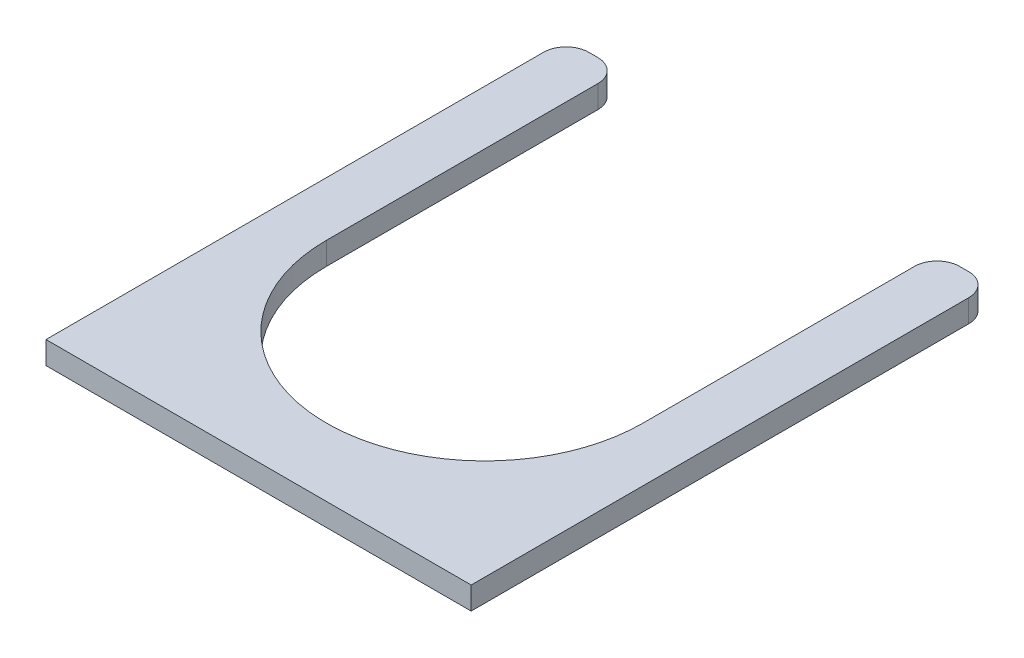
SolidWorks part; units mm, degrees
ref_plane "Piano frontale" through (0, 0, 0) normal (0, 0, 1) x (1, 0, 0)
ref_plane "Piano superiore" through (0, 0, 0) normal (0, 1, 0) x (1, 0, 0)
ref_plane "Piano destro" through (0, 0, 0) normal (1, 0, 0) x (0, 0, -1)
sketch "Schizzo1" plane through (0, 0, 0) normal (0, 1, 0) x (1, 0, 0)
  line L0 (0, 0) -> (0, 97.2212) construction
  line L2 (-47, 52.5) -> (-47, -57.5)
  line L3 (-47, -57.5) -> (47, -57.5)
  line L4 (47, 52.5) -> (47, -57.5)
  line L5 (-47, 57.5) -> (47, -57.5) construction
  line L6 (-47, -57.5) -> (47, 57.5) construction
  line L7 (-42, 57.5) -> (-40, 57.5)
  line L8 (42, 57.5) -> (40, 57.5)
  line L9 (-35, 52.5) -> (-35, -7.5)
  line L10 (35, 52.5) -> (35, -7.5)
  line L11 (0, -57.5) -> (0, -7.25) construction
  arc A0 (-35, -7.5) -> (35, -7.5) centre (0, -7.5) ccw
  arc A1 (42, 57.5) -> (47, 52.5) centre (42, 52.5) cw
  arc A2 (40, 57.5) -> (35, 52.5) centre (40, 52.5) ccw
  arc A3 (-40, 57.5) -> (-35, 52.5) centre (-40, 52.5) cw
  arc A4 (-42, 57.5) -> (-47, 52.5) centre (-42, 52.5) ccw
  point P0 (0, 0)
  point P20 (35, 57.5)
  point P23 (-35, 57.5)
base flange "Base-Flangia1" sketch "Schizzo1" thickness 5 reverse thickness direction no parameters "D1"=1.5
sketch "Linee di piegatura1" [suppressed] plane through (0, 0, 0) normal (0, 1, 0) x (1, 0, 0)
sketch "Casella di contorno1" [suppressed] plane through (0, 0, 0) normal (0, 1, 0) x (1, 0, 0)
sheet metal parameters "Lamiera1" thickness 5 parameters "D1"=1.5
flat pattern "Ripetizione piatta1"
sketch "Linee di piegatura2" plane through (0, 0, 0) normal (0, 1, 0) x (1, 0, 0)
sketch3d "Casella di contorno2" [suppressed]
  line L0 (89, 5, 0) -> (89, -110, 0) construction
  line L1 (-5, 5, 0) -> (-5, -110, 0) construction
  line L2 (89, 5, 0) -> (-5, 5, 0) construction
  line L3 (89, -110, 0) -> (-5, -110, 0) construction
equation "\"D4@Schizzo1\"=\"D3@Schizzo1\""
equation "\"D6@Schizzo1\"=\"D5@Schizzo1\""
